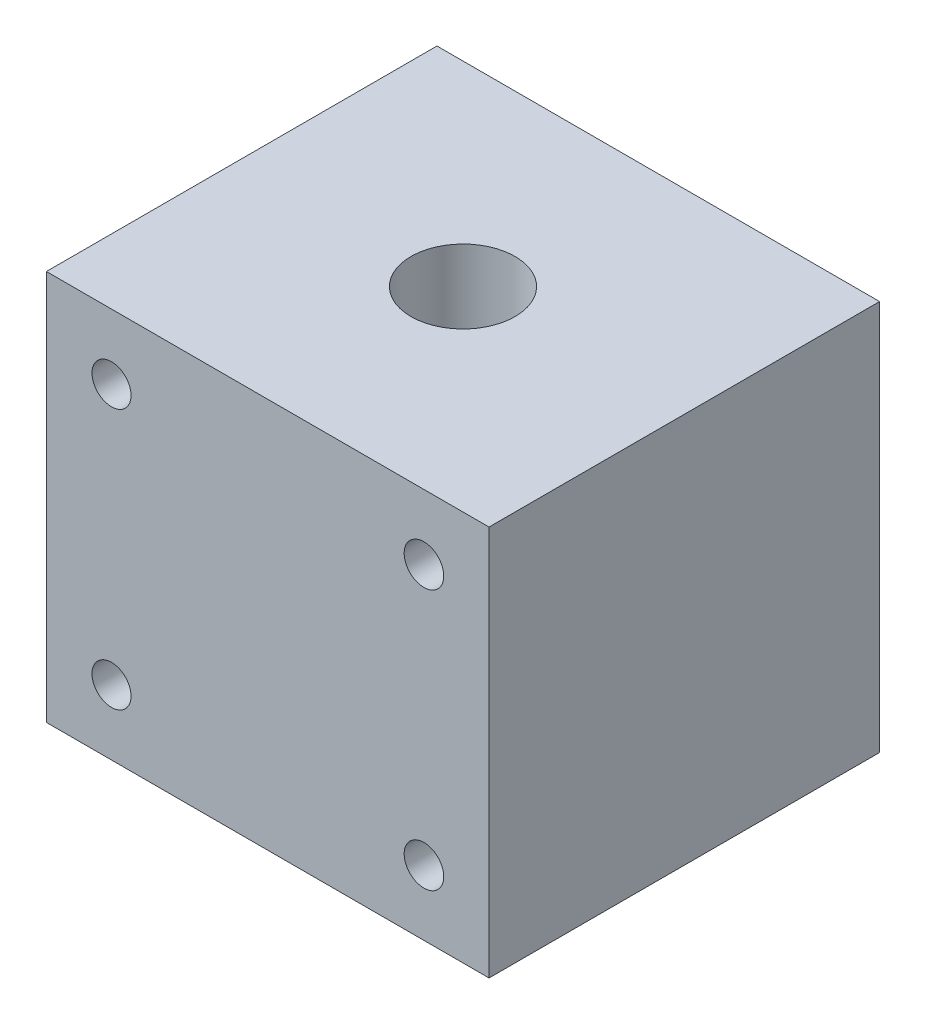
SolidWorks part; units mm, degrees
ref_plane "Alzado" through (0, 0, 0) normal (0, 0, 1) x (1, 0, 0)
ref_plane "Planta" through (0, 0, 0) normal (0, 1, 0) x (1, 0, 0)
ref_plane "Vista lateral" through (0, 0, 0) normal (1, 0, 0) x (0, 0, -1)
sketch "Croquis1" plane through (0, 0, 0) normal (0, 1, 0) x (1, 0, 0)
  line L0 (17, 30) -> (17, 0) construction
  line L1 (0, 0) -> (34, 0)
  line L2 (0, 0) -> (0, 30)
  line L3 (0, 30) -> (34, 30)
  line L4 (34, 0) -> (34, 30)
  circle A0 centre (17, 15) radius 4
  dimension "D3" = 8
  dimension "D1" = 30
  dimension "D2" = 34
extrude "Saliente-Extruir1" add sketch "Croquis1" along normal blind 30
sketch "Croquis2" plane through (0, 0, 0) normal (0, 0, 1) x (1, 0, 0)
  line L1 (0, 15) -> (34, 15) construction
  line L2 (0, 30) -> (0, 0) construction
  line L3 (34, 30) -> (34, 0) construction
  circle A0 centre (5, 25) radius 1.5
  circle A1 centre (29, 25) radius 1.5199
  circle A2 centre (29, 5) radius 1.5199
  circle A3 centre (5, 5) radius 1.5
  dimension "D1" = 24
  dimension "D2" = 20
  dimension "D3" = 20
  dimension "D4" = 5
extrude "Cortar-Extruir1" cut sketch "Croquis2" against normal blind 10
